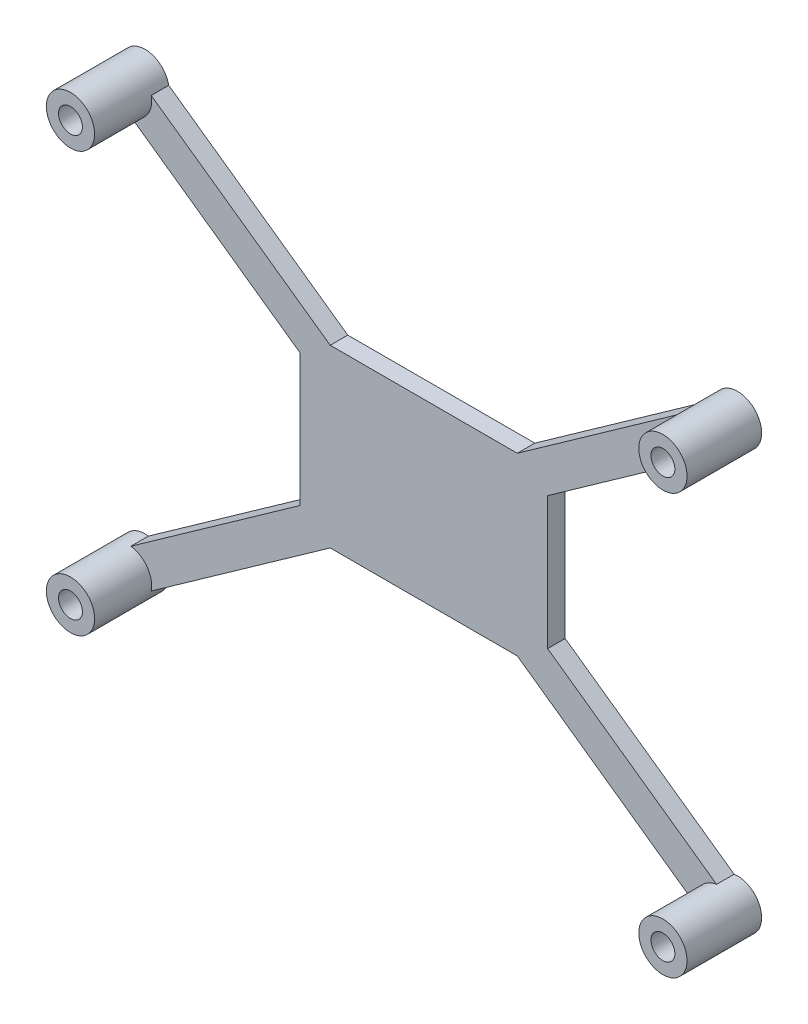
SolidWorks part; units mm, degrees
ref_plane "Front Plane" through (0, 0, 0) normal (0, 0, 1) x (1, 0, 0)
ref_plane "Top Plane" through (0, 0, 0) normal (0, 1, 0) x (1, 0, 0)
ref_plane "Right Plane" through (0, 0, 0) normal (1, 0, 0) x (0, 0, -1)
sketch "Sketch1" plane through (0, 0, 0) normal (0, 0, 1) x (1, 0, 0)
  line L0 (-42.8625, 30.3625) -> (42.8625, -30.3625) construction
  line L1 (42.8625, 30.3625) -> (-42.8625, -30.3625) construction
  line L2 (39.4382, 31.0496) -> (13.5343, 12.7)
  line L3 (-42.3747, 26.9042) -> (-17.9285, 9.5873)
  line L4 (42.3747, 26.9042) -> (17.9285, 9.5873)
  line L5 (-39.4382, 31.0496) -> (-13.5343, 12.7)
  line L6 (-44.3307, 28.2898) -> (41.3943, -32.4352) construction
  line L7 (-41.3943, 32.4352) -> (44.3307, -28.2898) construction
  line L8 (41.3943, 32.4352) -> (-44.3307, -28.2898) construction
  line L9 (44.3307, 28.2898) -> (-41.3943, -32.4352) construction
  line L10 (-17.9285, -9.5873) -> (-42.3747, -26.9042)
  line L11 (13.5343, -12.7) -> (39.4382, -31.0496)
  line L12 (17.9285, -9.5873) -> (42.3747, -26.9042)
  line L13 (-13.5343, -12.7) -> (-39.4382, -31.0496)
  line L15 (13.5343, -12.7) -> (-13.5343, -12.7)
  line L16 (17.9285, -9.5873) -> (17.9285, 9.5873)
  line L17 (13.5343, 12.7) -> (-13.5343, 12.7)
  line L18 (-17.9285, -9.5873) -> (-17.9285, 9.5873)
  line L19 (17.9285, -12.7) -> (-17.9285, 12.7) construction
  line L20 (17.9285, 12.7) -> (-17.9285, -12.7) construction
  arc A0 (-39.4382, 31.0496) -> (-42.3747, 26.9042) centre (-42.8625, 30.3625) ccw
  arc A1 (42.3747, 26.9042) -> (39.4382, 31.0496) centre (42.8625, 30.3625) ccw
  arc A2 (-42.3747, -26.9042) -> (-39.4382, -31.0496) centre (-42.8625, -30.3625) ccw
  arc A3 (39.4382, -31.0496) -> (42.3747, -26.9042) centre (42.8625, -30.3625) ccw
  circle A4 centre (-42.8625, 30.3625) radius 3.4925 construction
  point P26 (0, 0)
  dimension "D3" = 25.4
  dimension "D1" = 2.54
  dimension "D2" = 2.54
extrude "Boss-Extrude1" add sketch "Sketch1" along normal blind 2.54
hole_wizard "#4 Clearance Hole1" positions "Sketch3" profile "Sketch2" hole size "#4" standard "ANSI Inch"
sketch "Sketch3" plane through (0, 0, 2.54) normal (0, 0, 1) x (1, 0, 0)
  point P0 (-42.8625, 30.3625)
  point P3 (42.8625, 30.3625)
  point P6 (-42.8625, -30.3625)
  point P9 (42.8625, -30.3625)
sketch "Sketch2" plane through (-42.8625, 30.3625, 2.54) normal (1, 0, 0) x (0, -1, 0)
  line L0 (0, 0) -> (0, 7.3878)
  line L1 (0, 7.3878) -> (1.7272, 6.35)
  line L2 (1.7272, 6.35) -> (1.7272, 0)
  line L5 (1.7272, 0) -> (0, 0)
  line L10 (0, 7.3878) -> (-1.7272, 6.35) construction
  line L11 (0, -6.35) -> (0, 107.95) construction
  dimension "Hole Dia." = 3.4544
  dimension "Hole Depth" = 6.35
  dimension "Drill Angle" = 118
sketch "Sketch4" plane through (0, 0, 2.54) normal (0, 0, 1) x (1, 0, 0)
  circle A0 centre (-42.8625, 30.3625) radius 1.7272 construction
  circle A1 centre (-42.8625, 30.3625) radius 1.7272
  circle A2 centre (42.8625, 30.3625) radius 1.7272 construction
  circle A3 centre (42.8625, -30.3625) radius 1.7272 construction
  circle A4 centre (-42.8625, -30.3625) radius 1.7272 construction
  circle A5 centre (42.8625, 30.3625) radius 1.7272
  circle A6 centre (42.8625, -30.3625) radius 1.7272
  circle A7 centre (-42.8625, -30.3625) radius 1.7272
  circle A8 centre (42.8625, -30.3625) radius 3.4925
  circle A9 centre (-42.8625, -30.3625) radius 3.4925
  circle A10 centre (-42.8625, 30.3625) radius 3.4925
  circle A11 centre (42.8625, 30.3625) radius 3.4925
  arc A12 (42.3747, 26.9042) -> (39.4382, 31.0496) centre (42.8625, 30.3625) ccw construction
  arc A13 (39.4382, -31.0496) -> (42.3747, -26.9042) centre (42.8625, -30.3625) ccw construction
extrude "Boss-Extrude2" add sketch "Sketch4" along normal blind 8.255
